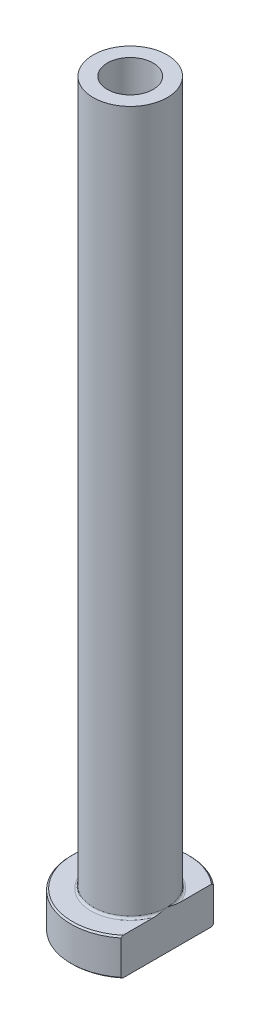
SolidWorks part; units mm, degrees
ref_plane "Front Plane" through (0, 0, 0) normal (0, 0, 1) x (1, 0, 0)
ref_plane "Top Plane" through (0, 0, 0) normal (0, 1, 0) x (1, 0, 0)
ref_plane "Right Plane" through (0, 0, 0) normal (1, 0, 0) x (0, 0, -1)
sketch "Sketch1" plane through (0, 0, 0) normal (0, 0, 1) x (1, 0, 0)
  line L0 (-3.1, 100) -> (-5, 100)
  line L1 (-5, 100) -> (-5, 5)
  line L2 (-5, 5) -> (-8, 5)
  line L3 (-8, 5) -> (-8, 0)
  line L4 (6.05, 0) -> (-6.05, 0) construction
  line L5 (-8, 0) -> (-3.35, 0)
  line L6 (-3.1, 55) -> (-3.1, 100)
  line L7 (0, 92.1877) -> (0, -15.5353) construction
  line L8 (0, -7.7) -> (0, 7.7) construction
  line L9 (-3.1, 55) -> (-3.35, 43)
  line L10 (-3.35, 43) -> (-3.35, 0)
  dimension "D1" = 0.25
  dimension "ID" = 6.2
  dimension "OD" = 10
  dimension "L" = 100
  dimension "H" = 16
  dimension "T" = 5
  dimension "N" = 45
  dimension "D2" = 12
  dimension "L-N" = 55
revolve "Revolve1" add sketch "Sketch1" angle 360 about L7
fillet "Fillet1" radius 0.3 1 edges at (0, 5, 5)
chamfer "Chamfer1" distance 0.2 angle 45 2 edges at (0, 5, 8) (0, 0, 8)
sketch "Sketch2" plane through (0, 0, 0) normal (0, -1, 0) x (1, 0, 0)
  line L0 (5, 6.245) -> (5, -6.245)
  circle A0 centre (0, 0) radius 8 construction
  arc A1 (5, 6.245) -> (5, -6.245) centre (0, 0) cw
  circle A2 centre (0, 0) radius 5 construction
extrude "Cut-Extrude1" cut sketch "Sketch2" against normal through all
chamfer "Chamfer2" distance 0.5 angle 45 1 edges at (0, 0, 3.35)
